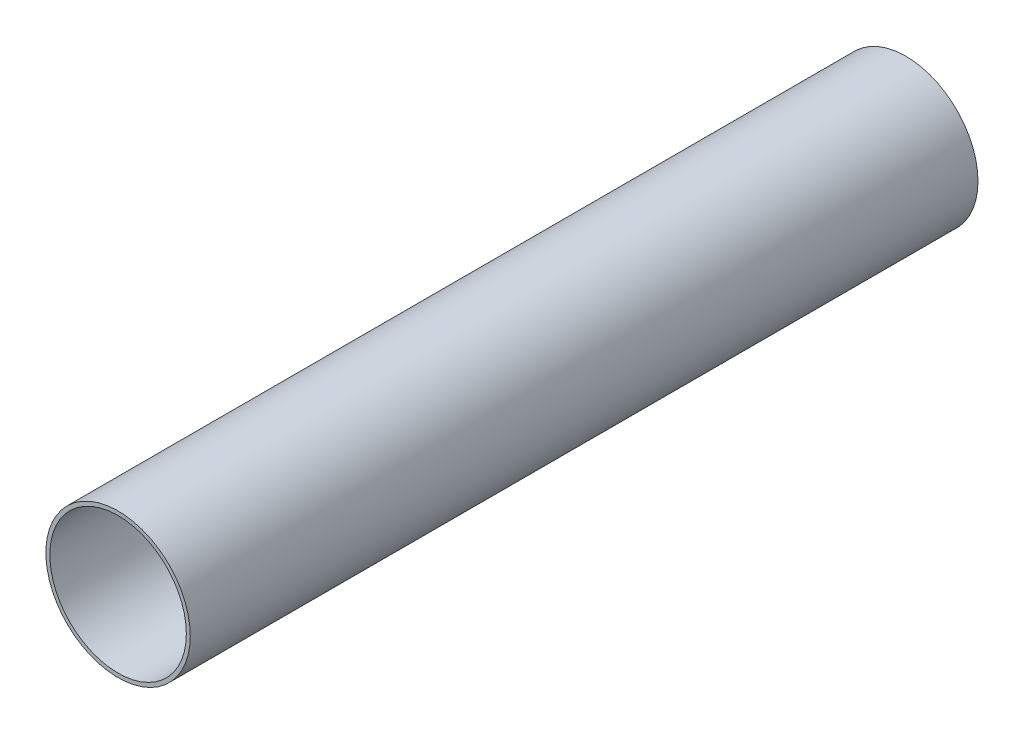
SolidWorks part; units mm, degrees
ref_plane "Face" through (0, 0, 0) normal (0, 0, 1) x (1, 0, 0)
ref_plane "Dessus" through (0, 0, 0) normal (0, 1, 0) x (1, 0, 0)
ref_plane "Droite" through (0, 0, 0) normal (1, 0, 0) x (0, 0, -1)
sketch "Esquisse1" plane through (0, 0, 0) normal (0, 0, 1) x (1, 0, 0)
  circle A0 centre (0, 0) radius 110
  circle A1 centre (0, 0) radius 104
  dimension "D1" = 220
  dimension "D2" = 208
extrude "Base-Extrusion" add sketch "Esquisse1" along normal blind 1200
